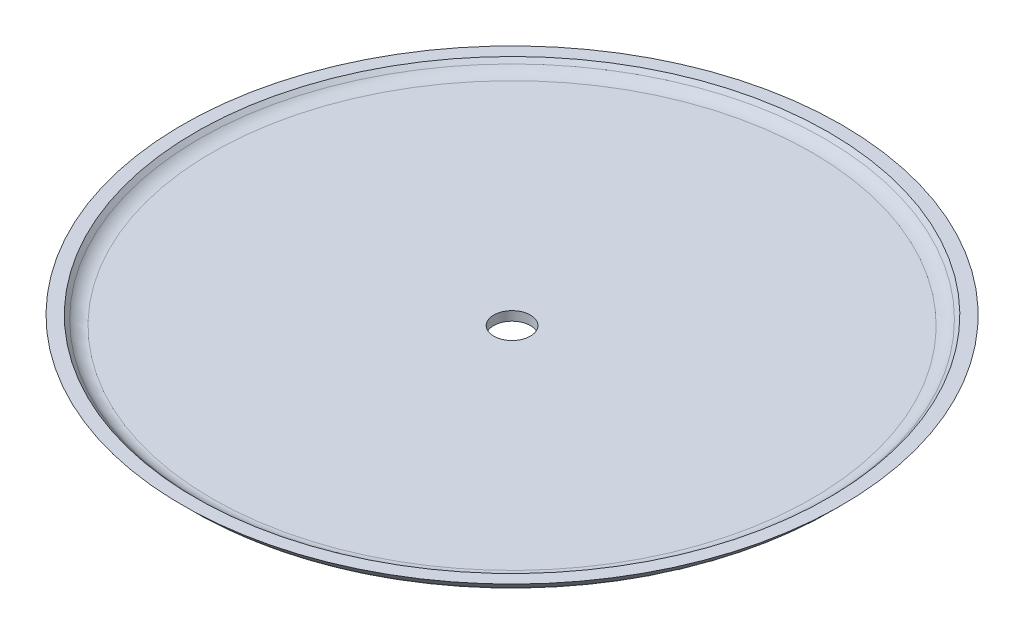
SolidWorks part; units mm, degrees
ref_plane "Face" through (0, 0, 0) normal (0, 0, 1) x (1, 0, 0)
ref_plane "Dessus" through (0, 0, 0) normal (0, 1, 0) x (1, 0, 0)
ref_plane "Droite" through (0, 0, 0) normal (1, 0, 0) x (0, 0, -1)
sketch "Esquisse1" plane through (0, 0, 0) normal (0, 0, 1) x (1, 0, 0)
  line L0 (0, 0) -> (0, 0.5)
  line L1 (0, 0.5) -> (-16.3787, 0.5)
  line L2 (-17.0858, 0.7929) -> (-17.2929, 1)
  line L3 (-17.2929, 1) -> (-18, 1)
  line L4 (-18, 1) -> (-17.4393, 0.4393)
  line L5 (-16.3787, 0) -> (0, 0)
  line L6 (0, 0.5) -> (0, 2.4645) construction
  arc A0 (-16.3787, 0.5) -> (-17.0858, 0.7929) centre (-16.3787, 1.5) cw
  arc A1 (-17.4393, 0.4393) -> (-16.3787, 0) centre (-16.3787, 1.5) ccw
  dimension "D2" = 1
  dimension "D3" = 18
  dimension "D1" = 0.5
  dimension "D4" = 45
  dimension "D5" = 1
revolve "Révolution1" add sketch "Esquisse1" angle 360 about L6
sketch "Esquisse2" plane through (0, 0.5, 0) normal (0, 1, 0) x (-1, 0, 0)
  circle A0 centre (0, 0) radius 1
  circle A1 centre (0, 0) radius 18 construction
  dimension "D1" = 2
extrude "Enlèv. mat.-Extru.1" cut sketch "Esquisse2" against normal up to next
sketch "Esquisse3" plane through (0, 0, 0) normal (0, 0, 1) x (1, 0, 0)
  line L0 (0, 1) -> (0, 82.068) construction
  line L1 (0, 1) -> (18, 1)
  line L2 (0, 1) -> (0, 0)
  line L3 (0, 0) -> (18, 0)
  line L4 (18, 1) -> (18, 0)
  line L6 (-16.3787, 0) -> (16.3787, 0) construction
  line L7 (17.2929, 1) -> (-17.2929, 1) construction
revolve "Coupe" [suppressed] cut sketch "Esquisse3" angle 180 about L0
